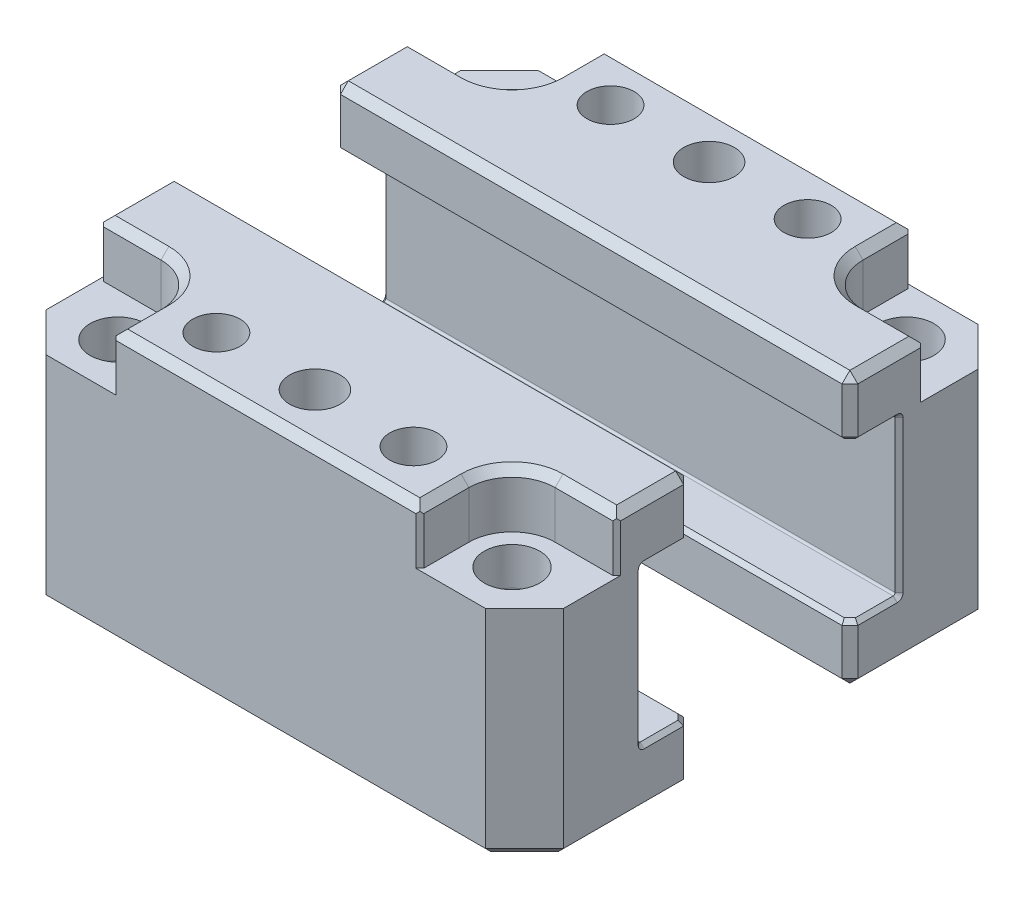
SolidWorks part; units mm, degrees
ref_plane "Front Plane" through (0, 0, 0) normal (0, 0, 1) x (1, 0, 0)
ref_plane "Top Plane" through (0, 0, 0) normal (0, 1, 0) x (1, 0, 0)
ref_plane "Right Plane" through (0, 0, 0) normal (1, 0, 0) x (0, 0, -1)
sketch "Sketch1" plane through (0, 0, 0) normal (1, 0, 0) x (0, 0, -1)
  line L0 (-10.2108, 0) -> (-10.2108, 34.925)
  line L1 (-10.2108, 34.925) -> (-31.7246, 34.925)
  line L2 (-31.7246, 34.925) -> (-31.7246, 0)
  line L3 (-31.7246, 0) -> (-10.2108, 0)
  line L4 (0, 48.255) -> (0, -16.2311) construction
  dimension "D1" = 20.4216
  dimension "D2" = 34.925
  dimension "D3" = 63.4492
  dimension "D4" = 21.5138
extrude "Boss-Extrude1" add sketch "Sketch1" along normal mid plane 66.675
hole_wizard "CBORE for 1/4 Socket Head Cap Screw1" positions "Sketch4" profile "Sketch3" counterbore size "1/4" standard "ANSI Inch"
sketch "Sketch4" plane through (0, 34.925, 0) normal (0, 1, 0) x (1, 0, 0)
  line L0 (0, 7.4267) -> (0, -36.2312) construction
  line L2 (-19.6518, 0) -> (14.0148, 0) construction
  point P0 (-25.4, -25.4)
  point P11 (25.4, -25.4)
  dimension "D1" = 50.8
  dimension "D2" = 50.8
sketch "Sketch3" plane through (-25.4, 34.925, 25.4) normal (1, 0, 0) x (0, 0, 1)
  line L0 (0, 0) -> (0, 34.925)
  line L1 (0, 34.925) -> (3.5712, 34.925)
  line L3 (3.5712, 34.925) -> (3.5712, 7.112)
  line L4 (3.5712, 7.112) -> (5.5562, 7.112)
  line L5 (5.5562, 7.112) -> (5.5562, 0)
  line L7 (5.5562, 0) -> (0, 0)
  line L11 (0, -6.35) -> (0, 107.95) construction
  dimension "Thru Hole Dia." = 7.1425
  dimension "Thru Hole Depth" = 34.925
  dimension "C'Bore Dia." = 11.1125
  dimension "C'Bore Depth" = 7.112
hole_wizard "5/16-18 Tapped Hole1" positions "Sketch6" profile "Sketch5" tap size "5/16-18" standard "ANSI Inch"
sketch "Sketch6" plane through (0, 34.925, 0) normal (0, 1, 0) x (1, 0, 0)
  line L0 (0, 2.7703) -> (0, -32.9614) construction
  line L2 (-8.3627, 0) -> (4.6629, 0) construction
  point P2 (0, -25.4)
sketch "Sketch5" plane through (0, 34.925, 25.4) normal (1, 0, 0) x (0, 0, 1)
  line L0 (0, 0) -> (0, 25.4053)
  line L1 (0, 25.4053) -> (3.2639, 23.4442)
  line L2 (3.2639, 23.4442) -> (3.2639, 0)
  line L5 (3.2639, 0) -> (0, 0)
  line L10 (0, 25.4053) -> (-3.2639, 23.4442) construction
  line L11 (0, -6.35) -> (0, 107.95) construction
  dimension "Tap Drill Dia." = 6.5278
  dimension "Tap Drill Depth" = 23.4442
  dimension "Drill Angle" = 118
chamfer "Chamfer1" distance 5 angle 45 2 edges at (33.3375, 17.4625, 31.7246) (-33.3375, 17.4625, 31.7246)
ref_plane "Plane2" through (0, 0, 25.4) normal (0, 0, 1) x (1, 0, 0)
sketch "Sketch16" plane through (0, 0, 25.4) normal (0, 0, 1) x (1, 0, 0)
  line L0 (-15.748, 34.925) -> (-15.748, 12.7763)
  line L1 (-15.748, 12.7763) -> (-15.875, 12.7)
  line L2 (-15.875, 12.7) -> (-15.875, 0)
  line L3 (-15.875, 0) -> (-12.7, 0)
  line L4 (-12.7, 0) -> (-12.7, 34.925) construction
  line L5 (-12.7, 34.925) -> (-15.748, 34.925)
  line L7 (28.3375, 0) -> (-28.3375, 0) construction
  line L8 (28.3375, 34.925) -> (-28.3375, 34.925) construction
  line L9 (-12.7, 0) -> (-12.7, 34.925)
  line L10 (0, 0) -> (0, 38.088) construction
  dimension "D1" = 6.35
  dimension "D2" = 25.4
  dimension "D3" = 6.096
  dimension "D4" = 59
  dimension "D5" = 12.7
revolve "Cut-Revolve1" cut sketch "Sketch16" angle 360 about L4
mirror "Mirror1" about plane through (0, 0, 0) normal (1, 0, 0) of "Cut-Revolve1"
sketch "Sketch8" plane through (0, 34.925, 0) normal (0, 1, 0) x (1, 0, 0)
  line L0 (-25.4, -19.8437) -> (-33.3375, -19.8437)
  line L2 (-33.3375, -10.2108) -> (-33.3375, -26.7246) construction
  line L3 (-33.3375, -19.8437) -> (-33.3375, -31.7246)
  line L4 (-33.3375, -31.7246) -> (-19.8437, -31.7246)
  line L5 (28.3375, -31.7246) -> (-28.3375, -31.7246) construction
  line L6 (-19.8437, -31.7246) -> (-19.8437, -25.4)
  line L7 (0, -6.8983) -> (0, -39.3984) construction
  line L8 (19.8438, -31.7246) -> (19.8438, -25.4)
  line L9 (33.3375, -31.7246) -> (19.8438, -31.7246)
  line L10 (33.3375, -19.8437) -> (33.3375, -31.7246)
  line L11 (25.4, -19.8437) -> (33.3375, -19.8437)
  circle A0 centre (-25.4, -25.4) radius 5.5562 construction
  circle A1 centre (-25.4, -25.4) radius 5.5562 construction
  arc A2 (-19.8437, -25.4) -> (-25.4, -19.8437) centre (-25.4, -25.4) ccw
  arc A3 (19.8438, -25.4) -> (25.4, -19.8437) centre (25.4, -25.4) cw
extrude "Cut-Extrude3" cut sketch "Sketch8" against normal up to surface (7.112 mm away)
sketch "Sketch9" plane through (0, 0, 10.2108) normal (0, 0, -1) x (-1, 0, 0)
  line L0 (0, 34.925) -> (0, 0) construction
  line L1 (-33.3375, 34.925) -> (33.3375, 34.925) construction
  line L2 (33.3375, 0) -> (33.3375, 34.925) construction
  line L3 (-33.3375, 27.4701) -> (33.3375, 27.4701)
  line L4 (-33.3375, 27.4701) -> (-33.3375, 7.4549)
  line L5 (-33.3375, 7.4549) -> (33.3375, 7.4549)
  line L6 (33.3375, 27.4701) -> (33.3375, 7.4549)
  line L7 (-33.3375, 27.4701) -> (33.3375, 7.4549) construction
  line L8 (-33.3375, 7.4549) -> (33.3375, 27.4701) construction
  point P5 (0, 17.4625)
  dimension "D1" = 20.0152
extrude "Cut-Extrude4" cut sketch "Sketch9" against normal offset from surface (6.35 mm away) 16.5608
hole_wizard "5/16-18 Tapped Hole2" positions "Sketch11" profile "Sketch10" tap size "5/16-18" standard "ANSI Inch"
sketch "Sketch11" plane through (0, 0, 0) normal (0, -1, 0) x (-1, 0, 0)
  point P0 (25.4, -25.4)
  point P3 (-25.4, -25.4)
sketch "Sketch10" plane through (-25.4, 0, 25.4) normal (1, 0, 0) x (0, 0, -1)
  line L0 (0, 0) -> (0, 25.0881)
  line L1 (0, 25.0881) -> (3.5814, 22.9362)
  line L2 (3.5814, 22.9362) -> (3.5814, 0)
  line L5 (3.5814, 0) -> (0, 0)
  line L10 (0, 25.0881) -> (-3.5814, 22.9362) construction
  line L11 (0, -6.35) -> (0, 107.95) construction
  dimension "Tap Drill Dia." = 7.1628
  dimension "Tap Drill Depth" = 22.9362
  dimension "Drill Angle" = 118
ref_plane "Plane1" through (0, 17.4625, 0) normal (0, 1, 0) x (1, 0, 0)
fillet "Fillet1" radius 0.254 2 edges at (0, 7.4549, 16.5608) (0, 27.4701, 16.5608)
chamfer "Chamfer2" distance 1.016 angle 45 20 edges at (0, 0, 10.2108) (33.3375, 3.7274, 10.2108) (33.3375, 0, 18.4677) (30.8375, 0, 29.2246) (0, 0, 31.7246) (-30.8375, 0, 29.2246) (-33.3375, 0, 18.4677) (-33.3375, 3.7274, 10.2108) (-21.4711, 34.925, 21.4711) (0, 34.925, 31.7246) (-33.3375, 34.925, 15.0273) (-33.3375, 31.1975, 10.2108) (0, 34.925, 10.2108) (21.4711, 34.925, 21.4711) (33.3375, 34.925, 15.0273) (33.3375, 31.1975, 10.2108) (-19.8437, 34.925, 28.5623) (-29.3687, 34.925, 19.8438) (19.8438, 34.925, 28.5623) (29.3687, 34.925, 19.8438)
chamfer "Chamfer3" distance 0.508 angle 45 20 edges at (33.3375, 27.4701, 13.7668) (33.3375, 27.3957, 16.4864) (33.3375, 17.4625, 16.5608) (33.3375, 7.5293, 16.4864) (33.3375, 7.4549, 13.7668) (0, 7.4549, 10.2108) (0, 27.4701, 10.2108) (-33.3375, 7.4549, 13.7668) (-33.3375, 7.5293, 16.4864) (-33.3375, 17.4625, 16.5608) (-33.3375, 27.3957, 16.4864) (-33.3375, 27.4701, 13.7668) (32.8295, 7.4549, 10.7188) (-32.8295, 7.4549, 10.7188) (32.8295, 27.4701, 10.7188) (-32.8295, 27.4701, 10.7188) (33.3375, 30.861, 19.8438) (19.8438, 30.861, 31.7246) (-19.8437, 30.861, 31.7246) (-33.3375, 30.861, 19.8438)
chamfer "Chamfer4" distance 0.508 angle 45 2 edges at (12.7, 0, 22.225) (-12.7, 0, 22.225)
mirror "Mirror2" about plane through (0, 0, 0) normal (0, 0, 1)
